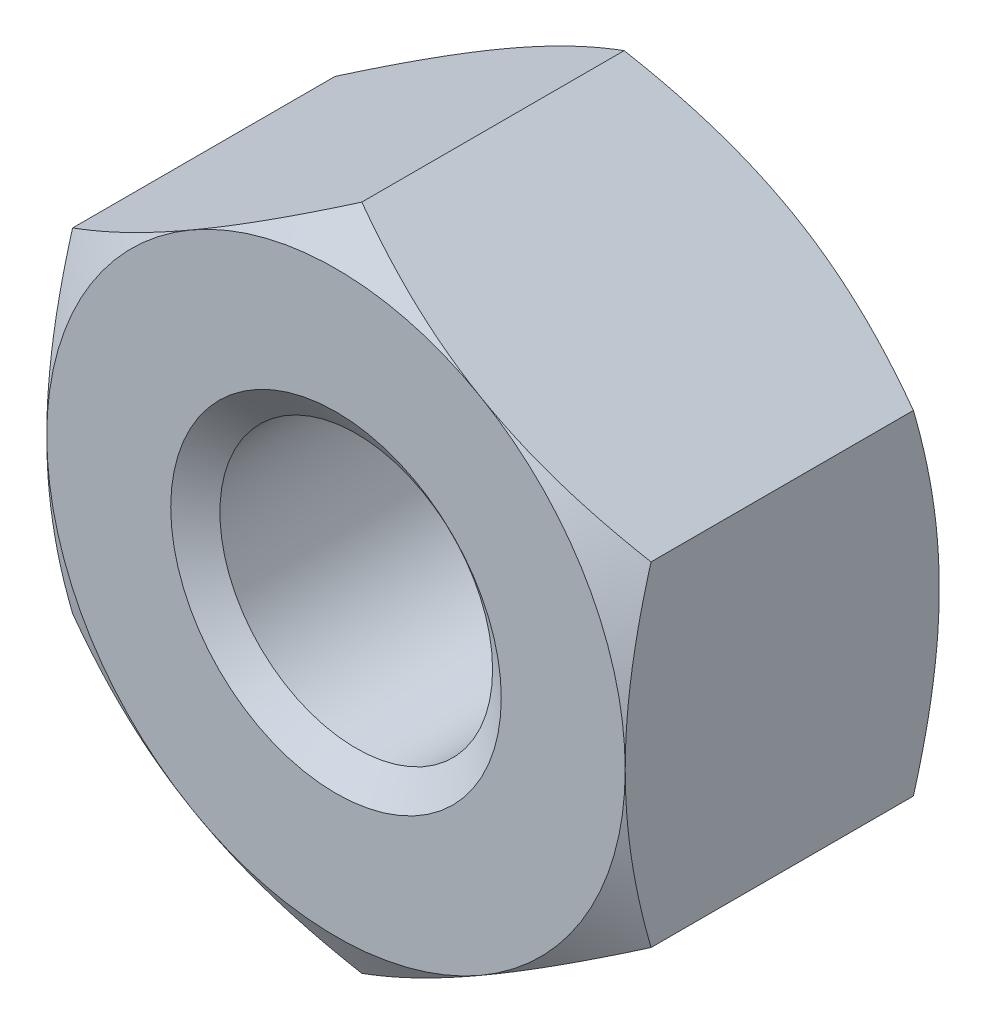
SolidWorks part; units mm, degrees
ref_plane "Plane1" through (0, 0, 0) normal (0, 0, 1) x (1, 0, 0)
ref_plane "Plane2" through (0, 0, 0) normal (0, 1, 0) x (1, 0, 0)
ref_plane "Plane3" through (0, 0, 0) normal (1, 0, 0) x (0, 0, -1)
revolve "EndChamfer" cut sketch "Sketch5"
sketch "Sketch5"
  line L0 (3.7746, 2) -> (3.505, 1.615)
  line L1 (3.8254, 2) -> (3.7746, 2)
  line L2 (3.8254, 2) -> (3.8254, 1.615)
  line L3 (3.8254, 1.615) -> (3.505, 1.615)
  line L6 (-0.0508, 2) -> (0, 2)
  line L7 (0, 2) -> (0.2696, 1.615)
  line L9 (0.2696, 1.615) -> (-0.0508, 1.615)
  line L10 (-0.0508, 1.615) -> (-0.0508, 2)
  line L11 (25.0375, 0) -> (38.388, 0) construction
  line L12 (3.8, 0) -> (0, 0) construction
extrude "BaseNut" add sketch "BaseNutSke" against normal blind 3.8
sketch "BaseNutSke" plane through (0, 0, 0) normal (0, 0, 1) x (1, 0, 0)
  line L6 (3.5, 2.0207) -> (3.5, -2.0207)
  line L7 (-3.5, 2.0207) -> (-3.5, -2.0207)
  line L8 (3.5, 2.0207) -> (0, 4.0415)
  line L9 (0, 4.0415) -> (-3.5, 2.0207)
  line L10 (-3.5, -2.0207) -> (0, -4.0415)
  line L11 (0, -4.0415) -> (3.5, -2.0207)
  circle A0 centre (0, 0) radius 1.65
  dimension "D4" = 3.5
  dimension "Tap_drill" = 3.3
  dimension "D1" = 120
  dimension "D2" = 3.5
  dimension "D3" = 3.5
  dimension "Width_flats" = 7
pattern_linear "ThdSchPat" [suppressed]
revolve "ThreadSchematic" cut sketch "ThdSchSke" angle 360 about L11
sketch "ThdSchSke" plane through (0, 0, 0) normal (0, 1, 0) x (1, 0, 0)
  line L0 (-2, 0.0254) -> (-1.65, 0.2705)
  line L1 (-1.65, 0.2705) -> (-0.825, 0.2705)
  line L2 (-0.825, 0.2705) -> (-0.825, -0.2197)
  line L3 (-0.825, -0.2197) -> (-1.65, -0.2197)
  line L4 (-1.65, -0.2197) -> (-2, 0.0254)
  line L5 (-3.175, 0.7) -> (3.175, 0.7) construction
  line L6 (0, 0.7) -> (0, -2.9874) construction
  line L7 (0, 3.5295) -> (0, 0.2451) construction
  dimension "D1" = 35
  dimension "VeeAngle" = 70
  dimension "SideAngle" = 55
  dimension "D2" = 0.0508
  dimension "OverCut" = 1.65
  dimension "Tap_Drill" = 3.3
  dimension "Advance" = 0.6249
  dimension "Thread_major" = 4
  dimension "Num_threads" = 7
  dimension "D4" = 50
  dimension "Offset1" = 3.8254
  dimension "ThreadMajor" = 2
  dimension "ChamferDepth" = 0.385
  dimension "Offset2" = 3.8762
sketch "Sketch4" plane through (0, 0, 0) normal (1, 0, 0) x (0, 0, -1)
  line L0 (3.8, 3.5) -> (3.79, 3.5)
  line L1 (3.8, 3.5) -> (3.8, 14.0415)
  line L2 (3.79, 14.0415) -> (3.8, 14.0415)
  line L3 (3.79, 14.0415) -> (3.79, 3.5)
  line L4 (0, 0) -> (34.925, 0) construction
  line L6 (3.8, 2.0207) -> (3.8, 4.0415) construction
  line L7 (0, 3.5) -> (-10, 3.5)
  line L8 (0, 2.0207) -> (0, 4.0415) construction
  line L9 (0.3126, 4.0415) -> (0.3126, 14.0415)
  line L10 (0.3126, 14.0415) -> (-10, 14.0415)
  line L11 (-10, 14.0415) -> (-10, 3.5)
  line L12 (0, 3.5) -> (0.3126, 4.0415)
  line L14 (0, 2.0207) -> (0, -2.0207) construction
  line L15 (3.8, 4.0415) -> (0, 4.0415) construction
  dimension "D1" = 3.5
  dimension "D2" = 30
  dimension "Bearing_ht" = 0.01
  dimension "D3" = 10
  dimension "D4" = 10
revolve "Bearing-Face" [suppressed] cut sketch "Sketch4" angle 360 about L4
sketch "Sketch3" plane through (0, 0, 0) normal (1, 0, 0) x (0, 0, -1)
  line L0 (3.8, 3.5) -> (3.4874, 4.0415)
  line L1 (3.4874, 4.0415) -> (3.4874, 14.0415)
  line L2 (3.4874, 14.0415) -> (13.8, 14.0415)
  line L3 (13.8, 14.0415) -> (13.8, 3.5)
  line L4 (13.8, 3.5) -> (3.8, 3.5)
  line L5 (3.8, 2.0207) -> (3.8, 4.0415) construction
  line L6 (3.8, 4.0415) -> (0, 4.0415) construction
  line L7 (0, 0) -> (38.6776, 0) construction
  line L8 (3.8, 0) -> (0, 0) construction
  line L9 (1.9, 4.0415) -> (1.9, 44.222) construction
  line L10 (0.3126, 14.0415) -> (-10, 14.0415)
  line L11 (-10, 14.0415) -> (-10, 3.5)
  line L12 (-10, 3.5) -> (0, 3.5)
  line L13 (0, 3.5) -> (0.3126, 4.0415)
  line L14 (0.3126, 4.0415) -> (0.3126, 14.0415)
  line L16 (3.8, 4.0415) -> (0, 4.0415) construction
  dimension "D1" = 3.5
  dimension "D2" = 30
  dimension "D3" = 10
  dimension "D4" = 10
revolve "Double-Chamfer" cut sketch "Sketch3" angle 360 about L7
equation "\"D2@BaseNutSke\" = \"Width_flats@BaseNutSke\" / 2"
equation "\"D3@BaseNutSke\" = \"Width_flats@BaseNutSke\" / 2"
equation "\"D1@Sketch3\" = \"Width_flats@BaseNutSke\" /2"
equation "\"D1@Sketch4\" = \"D2@BaseNutSke\""
equation "\"D4@BaseNutSke\" = \"D3@BaseNutSke\""
equation "\"Thread_major@ThdSchSke\" = \"Thread_major@ThreadCosmetic\""
equation "\"Tap_drill@ThdSchSke\" = \"Tap_drill@BaseNutSke\""
equation "\"Overcut@ThdSchSke\" = \"Tap_drill@ThdSchSke\" * 0.5"
equation "\"Num_threads@ThdSchPat\" = int(  ( \"Thickness@BaseNut\" - 0.0508 ) / \"Advance@ThdSchSke\" + 0.999 )  + 1"
equation "\"Advance@ThdSchPat\" = ( \"Thickness@BaseNut\" - 0.0508 ) /  (\"Num_threads@ThdSchPat\" - 1) 'relax it"
equation "' \"Num_threads@ThdSchPat\" = \"Num_threads@ThdSchPat\" - sgn( \"Num_threads@ThdSchPat\" - 1) '---chamfered tips only---"
equation "\"ThreadMajor@Sketch5\" = \"Thread_major@ThreadCosmetic\" * 0.5"
equation "\"ChamferDepth@Sketch5\" = (\"Thread_major@ThreadCosmetic\" - \"Tap_drill@BaseNutSke\") * 0.55"
equation "\"Offset1@Sketch5\" = \"Thickness@BaseNut\" + 0.0254"
equation "\"Offset2@Sketch5\" = \"Offset1@Sketch5\" + 0.0508"
